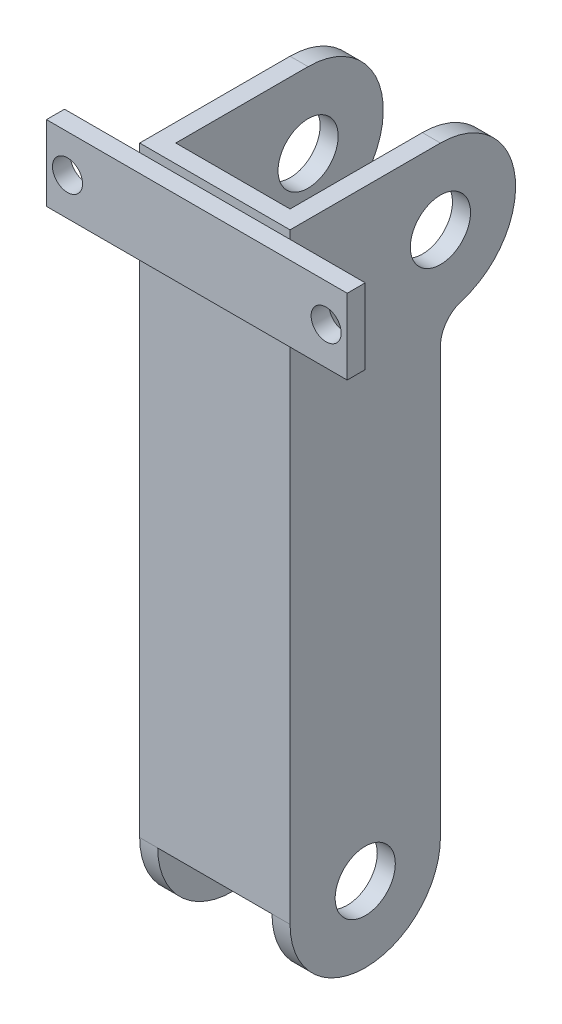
SolidWorks part; units mm, degrees
ref_plane "Front Plane" through (0, 0, 0) normal (0, 0, 1) x (1, 0, 0)
ref_plane "Top Plane" through (0, 0, 0) normal (0, 1, 0) x (1, 0, 0)
ref_plane "Right Plane" through (0, 0, 0) normal (1, 0, 0) x (0, 0, -1)
sketch "Sketch1" plane through (0, 0, 0) normal (1, 0, 0) x (0, 0, -1)
  line L0 (-41.9739, 0) -> (35.1158, 0) construction
  line L4 (25, 0) -> (25, 141.459)
  line L5 (25, 200) -> (-25, 200)
  line L6 (-25, 0) -> (-25, 200)
  circle A0 centre (0, 0) radius 10
  arc A1 (-25, 0) -> (25, 0) centre (0, 0) ccw
  circle A3 centre (25, 175) radius 10
  arc A4 (32.1429, 151.0421) -> (25, 141.459) centre (35, 141.459) ccw
  arc A6 (32.1429, 151.0421) -> (25, 200) centre (25, 175) ccw
  point P0 (0, 0)
  point P19 (-25, 200)
  dimension "D3" = 20
  dimension "D5" = 20
  dimension "D6" = 10
  dimension "D1" = 50
  dimension "D2" = 200
extrude "Boss-Extrude1" add sketch "Sketch1" along normal blind 6
ref_plane "Plane1" through (25, 0, 0) normal (-1, 0, 0) x (0, 0, 1)
sketch "Sketch6" plane through (0, 0, 25) normal (0, 0, 1) x (1, 0, 0)
  line L1 (0, 0) -> (50, 0)
  line L2 (0, 0) -> (0, 200)
  line L3 (0, 200) -> (50, 200)
  line L4 (50, 0) -> (50, 200)
  dimension "D1" = 200
  dimension "D2" = 50
extrude "Boss-Extrude5" add sketch "Sketch6" against normal blind 6
mirror "Mirror1" about plane through (25, 0, 0) normal (-1, 0, 0) of "Boss-Extrude1"
sketch "Sketch10" plane through (0, 0, 25) normal (0, 0, 1) x (1, 0, 0)
  line L0 (0, 170.131) -> (50, 170.131) construction
  line L1 (75, 197.2442) -> (-25, 197.2442)
  line L2 (75, 197.2442) -> (75, 172.2442)
  line L3 (75, 172.2442) -> (-25, 172.2442)
  line L4 (-25, 197.2442) -> (-25, 172.2442)
  line L5 (0, 200) -> (0, 0) construction
  line L6 (50, 0) -> (50, 200) construction
  line L7 (25, 197.2442) -> (25, 155.57) construction
  line L8 (-25, 184.7442) -> (75, 184.7442) construction
  circle A0 centre (-18, 184.7442) radius 5
  circle A1 centre (68, 184.7442) radius 5
  point P4 (25, 170.131)
  point P11 (25, 197.2442)
  dimension "D2" = 10
  dimension "D4" = 25
  dimension "D1" = 100
  dimension "D3" = 43
extrude "Boss-Extrude6" add sketch "Sketch10" along normal blind 6
